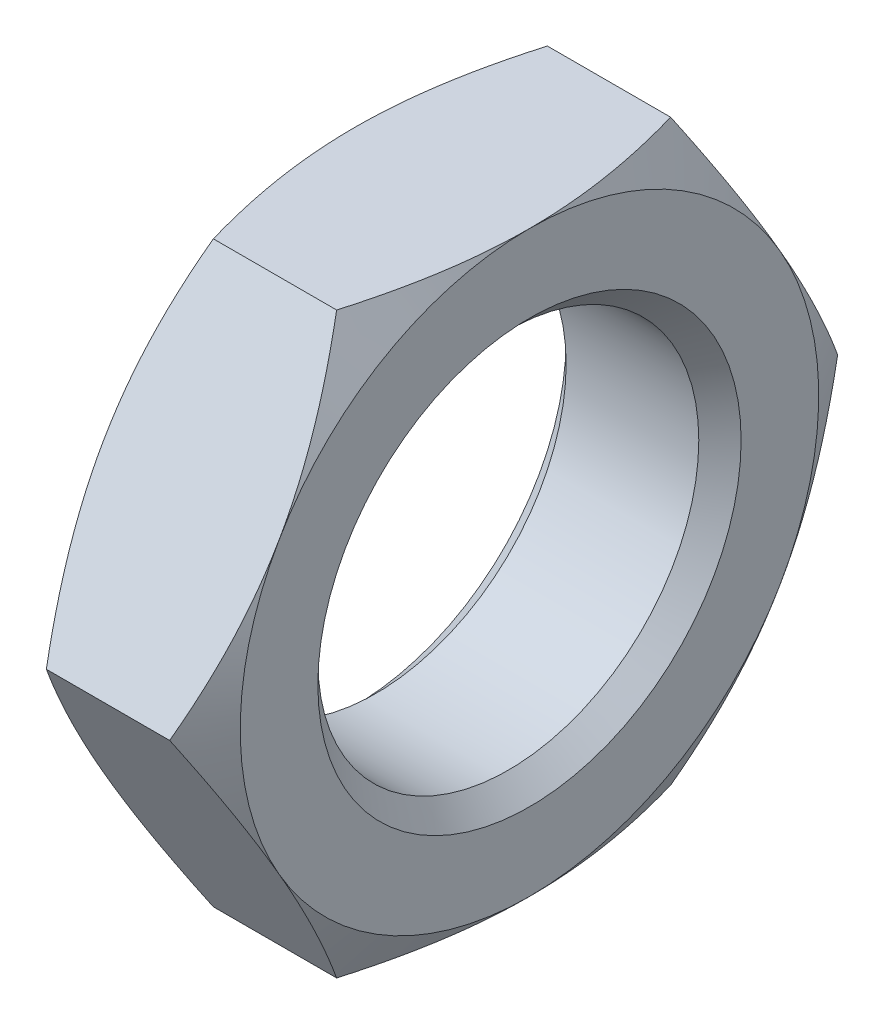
SolidWorks part; units mm, degrees
ref_plane "Front Plane" through (0, 0, 0) normal (0, 0, 1) x (1, 0, 0)
ref_plane "Top Plane" through (0, 0, 0) normal (0, 1, 0) x (1, 0, 0)
ref_plane "Right Plane" through (0, 0, 0) normal (1, 0, 0) x (0, 0, -1)
sketch "Sketch1" plane through (0, 0, 0) normal (1, 0, 0) x (0, 0, -1)
  line L1 (11.8357, 20.5) -> (-11.8357, 20.5)
  line L2 (-11.8357, 20.5) -> (-23.6714, 0)
  line L3 (-23.6714, 0) -> (-11.8357, -20.5)
  line L4 (-11.8357, -20.5) -> (11.8357, -20.5)
  line L5 (11.8357, -20.5) -> (23.6714, 0)
  line L6 (23.6714, 0) -> (11.8357, 20.5)
  circle A0 centre (0, 0) radius 20.5 construction
  circle A1 centre (0, 0) radius 13.5
extrude "Extrude1" add sketch "Sketch1" along normal blind 12.4
sketch "Sketch2" plane through (0, 0, 0) normal (0, 0, 1) x (1, 0, 0)
  line L0 (12.4, 20.5) -> (12.4, 82)
  line L1 (12.4, 82) -> (0, 82)
  line L2 (0, 82) -> (0, 20.5)
  line L3 (0, 20.5) -> (6.2, 31.2387)
  line L4 (6.2, 31.2387) -> (12.4, 20.5)
revolve "Cut-Revolve1" cut sketch "Sketch2" angle 360 about axis through (12.4, 0, 0) along (-1, 0, 0)
chamfer "Chamfer1" distance 1.5 angle 45 2 edges at (0, 0, -13.5) (12.4, 0, -13.5)
equation "\"D2@Sketch2\"=\"D1@Sketch1\"*2"
